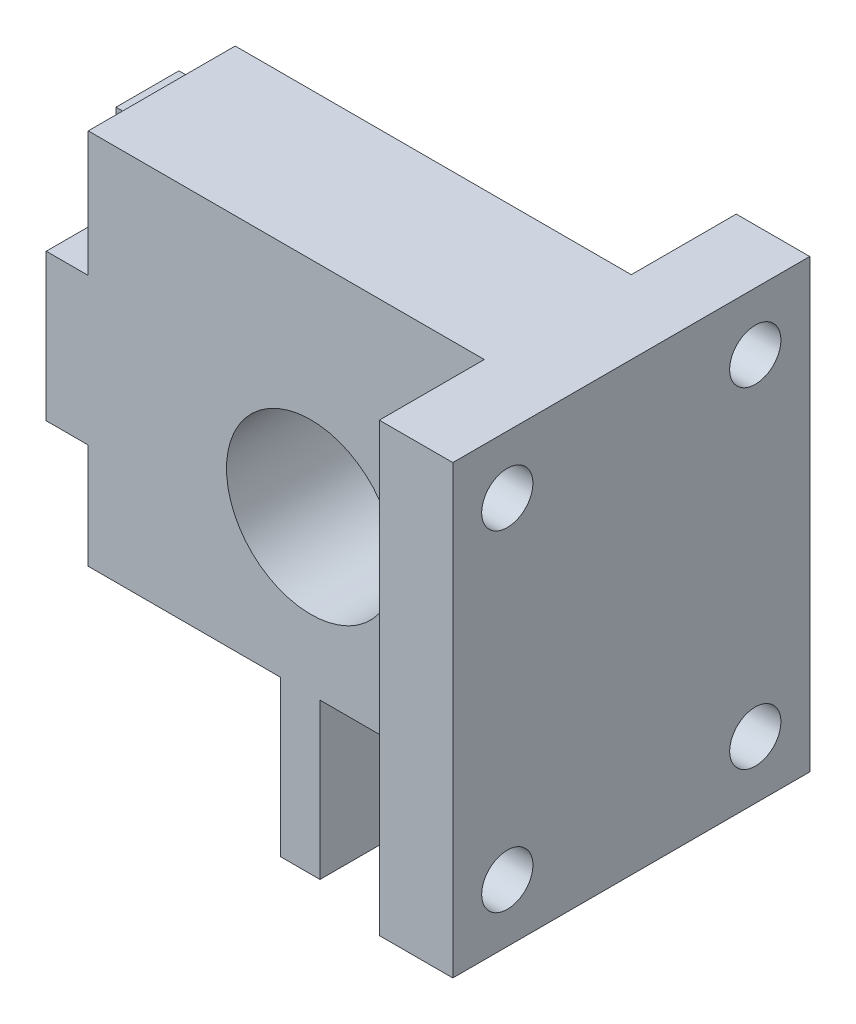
SolidWorks part; units mm, degrees
ref_plane "Front" through (0, 0, 0) normal (0, 0, 1) x (1, 0, 0)
ref_plane "Top" through (0, 0, 0) normal (0, 1, 0) x (1, 0, 0)
ref_plane "Right" through (0, 0, 0) normal (1, 0, 0) x (0, 0, -1)
sketch "Sketch1" plane through (0, 0, 0) normal (0, 0, 1) x (1, 0, 0)
  line L0 (53.34, 11.811) -> (53.34, -11.811) construction
  line L1 (-9.271, 13.5001) -> (40.34, 13.5001)
  line L2 (-9.271, 13.5001) -> (-9.271, -13.5001)
  line L3 (-9.271, -13.5001) -> (40.34, -13.5001)
  line L4 (40.34, 13.5001) -> (40.34, -13.5001)
  circle A0 centre (0, 0) radius 7.9375 construction
  circle A1 centre (25.4, 0) radius 8.5 construction
  point P4 (-9.271, 0)
  dimension "D1" = 15.875
  dimension "D2" = 17
  dimension "D9" = 13
  dimension "D4" = 25.4
  dimension "D6" = 53.34
  dimension "D7" = 27.0002
  dimension "D8" = 9.271
extrude "Extrude1" add sketch "Sketch1" along normal blind 8.89
hole_wizard "M12x1.0 Tapped Hole1" positions "Sketch4" profile "Sketch3" tap size "M12x1.75" standard "Ansi Metric"
sketch "Sketch4" plane through (0, 0, 8.89) normal (0, 0, 1) x (1, 0, 0)
  point P0 (25.4, 0)
sketch "Sketch3" plane through (25.4, 0, 8.89) normal (1, 0, 0) x (0, -1, 0)
  line L0 (0, 0) -> (0, 8.89)
  line L1 (0, 8.89) -> (5.1, 8.89)
  line L2 (5.1, 8.89) -> (5.1, 0)
  line L5 (5.1, 0) -> (0, 0)
  line L11 (0, -6.35) -> (0, 107.95) construction
  dimension "Thru Tap Drill Dia." = 10.2
  dimension "Thru Tap Drill Depth" = 8.89
sketch "Sketch12" plane through (0, 0, 0) normal (0, 0, -1) x (-1, 0, 0)
  circle A0 centre (0, 0) radius 7.9375
  dimension "D1" = 15.875
extrude "Extrude2" add sketch "Sketch12" along normal blind 3.81
hole_wizard "3/8 (0.375000) Diameter Hole1" positions "Sketch7" profile "Sketch6" hole size "3/8" standard "Ansi Inch"
sketch "Sketch7" plane through (0, 0, 8.89) normal (0, 0, 1) x (1, 0, 0)
  point P0 (0, 0)
sketch "Sketch6" plane through (0, 0, 8.89) normal (1, 0, 0) x (0, -1, 0)
  line L0 (0, 0) -> (0, 28.2616)
  line L1 (0, 28.2616) -> (4.7625, 25.4)
  line L2 (4.7625, 25.4) -> (4.7625, 0)
  line L5 (4.7625, 0) -> (0, 0)
  line L10 (0, 28.2616) -> (-4.7625, 25.4) construction
  line L11 (0, -6.35) -> (0, 107.95) construction
  dimension "Hole Dia." = 9.525
  dimension "Hole Depth" = 25.4
  dimension "Drill Angle" = 118
chamfer "Chamfer1" [suppressed] distance 8.89 angle 45
sketch "Sketch16" plane through (0, 0, 0) normal (0, 0, -1) x (-1, 0, 0)
  line L0 (-40.34, 13.5001) -> (9.271, 13.5001) construction
  line L1 (-40.34, -13.5001) -> (-35.895, -13.5001)
  line L2 (-40.34, -13.5001) -> (-40.34, 13.5001)
  line L3 (-40.34, 13.5001) -> (-35.895, 13.5001)
  line L4 (-35.895, -13.5001) -> (-35.895, 13.5001)
  dimension "D1" = 4.445
extrude "Extrude4" add sketch "Sketch16" along normal blind 6.35
ref_plane "Plane1" through (0, 0, 4.445) normal (0, 0, 1) x (1, 0, 0)
sketch "Sketch19" plane through (0, 0, 8.89) normal (0, 0, 1) x (1, 0, 0)
  line L0 (35.895, -13.5001) -> (35.895, 13.5001) construction
  line L1 (40.34, 13.5001) -> (35.895, 13.5001)
  line L2 (40.34, 13.5001) -> (40.34, -13.5001)
  line L3 (40.34, -13.5001) -> (35.895, -13.5001)
  line L4 (35.895, 13.5001) -> (35.895, -13.5001)
  line L5 (-9.271, -13.5001) -> (40.34, -13.5001) construction
extrude "Extrude5" add sketch "Sketch19" along normal blind 6.35
hole_wizard "M3.1 (3.100000) Diameter Hole2" positions "Sketch18" profile "Sketch17" hole size "M3.1" standard "Ansi Metric"
sketch "Sketch18" plane through (35.895, 0, 0) normal (-1, 0, 0) x (0, 0, 1)
  line L0 (15.24, 13.5001) -> (8.89, 13.5001) construction
  line L1 (-6.35, 13.5001) -> (0, 13.5001) construction
  line L2 (-6.35, -13.5001) -> (-6.35, 13.5001) construction
  line L3 (8.89, 13.5001) -> (0, 13.5001) construction
  point P0 (-3.055, 10)
  point P1 (-3.055, -10)
  point P6 (11.945, 10)
  point P7 (11.945, -10)
  dimension "D1" = 3.5001
  dimension "D2" = 3.5001
  dimension "D3" = 3.295
  dimension "D4" = 15
  dimension "D5" = 23.5001
  dimension "D6" = 23.5001
  dimension "D7" = 20
  dimension "D8" = 20
sketch "Sketch17" plane through (35.895, 10, -3.055) normal (0, 1, 0) x (0, 0, 1)
  line L0 (0, 0) -> (0, 4.445)
  line L1 (0, 4.445) -> (1.55, 4.445)
  line L2 (1.55, 4.445) -> (1.55, 0)
  line L5 (1.55, 0) -> (0, 0)
  line L11 (0, -6.35) -> (0, 107.95) construction
  dimension "Thru Hole Dia." = 3.1
  dimension "Thru Hole Depth" = 4.445
sketch "Sketch20" plane through (0, 0, 0) normal (0, 0, -1) x (-1, 0, 0)
  line L0 (-24.765, 1.4431) -> (-24.765, -20.0804) construction
  line L1 (-32.385, -9.3091) -> (9.271, -9.3091)
  line L2 (-32.385, -9.3091) -> (-32.385, -15.3438)
  line L3 (-32.385, -15.3438) -> (9.271, -15.3438)
  line L4 (9.271, -9.3091) -> (9.271, -15.3438)
  line L5 (9.271, -13.5001) -> (-35.895, -13.5001) construction
  line L6 (9.271, 13.5001) -> (9.271, -13.5001) construction
  dimension "D1" = 24.765
  dimension "D2" = 4.191
  dimension "D3" = 7.62
extrude "Cut-Extrude1" cut sketch "Sketch20" against normal through all
sketch "Sketch21" plane through (0, -9.3091, 0) normal (0, -1, 0) x (1, 0, 0)
  line L0 (32.385, 8.89) -> (-9.271, 8.89) construction
  line L1 (23.5744, 8.89) -> (25.9556, 8.89)
  line L2 (23.5744, 8.89) -> (23.5744, 0)
  line L3 (23.5744, 0) -> (25.9556, 0)
  line L4 (25.9556, 8.89) -> (25.9556, 0)
  line L5 (-9.271, 0) -> (32.385, 0) construction
  line L6 (24.765, 8.89) -> (24.765, 3.3753) construction
  dimension "D1" = 2.3813
  dimension "D2" = 24.765
extrude "Extrude6" add sketch "Sketch21" along normal blind 9.398
ref_plane "SENSOR" through (24.765, 0, 0) normal (1, 0, 0) x (0, 0, -1)
chamfer "Chamfer2" distance 8.89 angle 45 1 edges at (-9.271, 13.5001, 4.445)
chamfer "Chamfer3" [suppressed] distance 1.778 angle 45
sketch "Sketch22" plane through (0, 0, 8.89) normal (0, 0, 1) x (1, 0, 0)
  line L0 (35.895, 13.5001) -> (-0.381, 13.5001) construction
  line L1 (-9.271, -9.3091) -> (11.938, -9.3091)
  line L2 (-9.271, -9.3091) -> (-9.271, 13.5001)
  line L3 (-9.271, 13.5001) -> (11.938, 13.5001)
  line L4 (11.938, -9.3091) -> (11.938, 13.5001)
  dimension "D1" = 11.938
extrude "Cut-Extrude2" cut sketch "Sketch22" against normal through all
sketch "Sketch23" plane through (11.938, 0, 0) normal (-1, 0, 0) x (0, 0, 1)
  line L0 (0, -9.3091) -> (0, 13.5001) construction
  line L1 (0, -2.9591) -> (8.89, -2.9591)
  line L2 (0, -2.9591) -> (0, 5.9258)
  line L3 (0, 5.9258) -> (8.89, 5.9258)
  line L4 (8.89, -2.9591) -> (8.89, 5.9258)
  line L5 (8.89, -9.3091) -> (8.89, 13.5001) construction
  line L6 (0, -9.3091) -> (8.89, -9.3091) construction
  dimension "D1" = 6.35
  dimension "D2" = 8.8849
extrude "Extrude8" add sketch "Sketch23" along normal blind 2.54
sketch "Sketch26" plane through (0, 0, 0) normal (0, 0, -1) x (-1, 0, 0)
  line L0 (-9.398, 5.9258) -> (-11.938, 5.9258) construction
  line L1 (-15.748, -2.9591) -> (-3.9624, -2.9591)
  line L2 (-15.748, -2.9591) -> (-15.748, 5.9258)
  line L3 (-15.748, 5.9258) -> (-3.9624, 5.9258)
  line L4 (-3.9624, -2.9591) -> (-3.9624, 5.9258)
  line L5 (-9.398, -2.9591) -> (-11.938, -2.9591) construction
  line L8 (-11.938, -9.3091) -> (-11.938, -2.9591) construction
  dimension "D1" = 3.81
  dimension "D2" = 11.7856
extrude "Extrude9" add sketch "Sketch26" along normal blind 4.572
sketch "Sketch27" plane through (0, 0, 0) normal (0, 0, 1) x (1, 0, 0)
  line L1 (3.9624, 5.9258) -> (9.398, 5.9258)
  line L2 (3.9624, 5.9258) -> (3.9624, -2.9591)
  line L3 (3.9624, -2.9591) -> (9.398, -2.9591)
  line L4 (9.398, 5.9258) -> (9.398, -2.9591)
extrude "Cut-Extrude4" cut sketch "Sketch27" against normal blind 0.762
hole_wizard "M3.5x0.6 Tapped Hole1" positions "Sketch29" profile "Sketch28" tap size "M3.5x0.6" standard "Ansi Metric"
sketch "Sketch29" plane through (0, 0, -4.572) normal (0, 0, -1) x (-1, 0, 0)
  line L0 (-3.9624, 5.9258) -> (-9.398, -2.9591) construction
  point P0 (-6.6802, 1.4834)
sketch "Sketch28" plane through (6.6802, 1.4834, -4.572) normal (1, 0, 0) x (0, 1, 0)
  line L0 (0, 0) -> (0, 19.812)
  line L1 (0, 19.812) -> (1.45, 19.812)
  line L2 (1.45, 19.812) -> (1.45, 0)
  line L5 (1.45, 0) -> (0, 0)
  line L11 (0, -6.35) -> (0, 107.95) construction
  dimension "Thru Tap Drill Dia." = 2.9
  dimension "Thru Tap Drill Depth" = 19.812
hole_wizard "#5-40 Tapped Hole1" positions "Sketch31" profile "Sketch30" tap size "#5-40" standard "Ansi Inch"
sketch "Sketch31" plane through (11.938, 0, 0) normal (-1, 0, 0) x (0, 0, 1)
  line L2 (0, 13.5001) -> (8.89, 13.5001) construction
  line L3 (15.24, 13.5001) -> (15.24, -13.5001) construction
  point P0 (4.445, -6.1414)
  point P1 (4.445, 9.7016)
  dimension "D1" = 3.7985
  dimension "D2" = 15.8431
  dimension "D3" = 10.795
  dimension "D4" = 10.795
sketch "Sketch30" plane through (11.938, -6.1414, 4.445) normal (0, 1, 0) x (0, 0, 1)
  line L0 (0, 0) -> (0, 6.985)
  line L1 (0, 6.985) -> (1.289, 6.985)
  line L2 (1.289, 6.985) -> (1.289, 0)
  line L5 (1.289, 0) -> (0, 0)
  line L10 (0, 6.985) -> (-1.2891, 6.985) construction
  line L11 (0, -6.35) -> (0, 107.95) construction
  dimension "Tap Drill Dia." = 2.5781
  dimension "Tap Drill Depth" = 6.985
  dimension "Drill Angle" = 180
